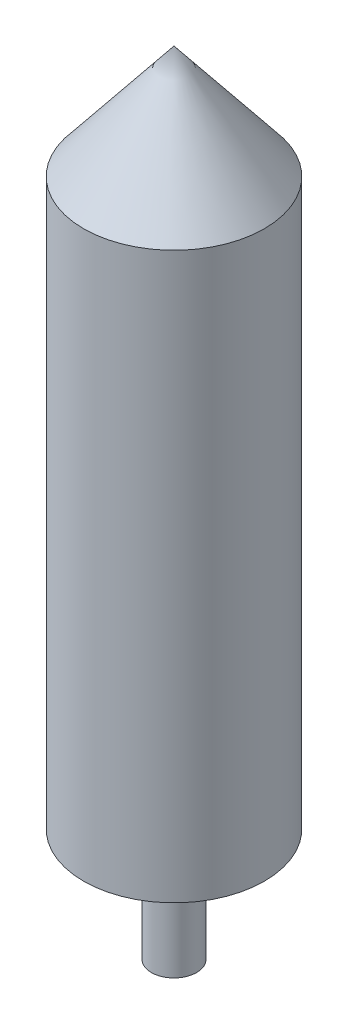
SolidWorks part; units mm, degrees
ref_plane "Front Plane" through (0, 0, 0) normal (0, 0, 1) x (1, 0, 0)
ref_plane "Top Plane" through (0, 0, 0) normal (0, 1, 0) x (1, 0, 0)
ref_plane "Right Plane" through (0, 0, 0) normal (1, 0, 0) x (0, 0, -1)
sketch "Sketch1" plane through (0, 0, 0) normal (0, 0, 1) x (1, 0, 0)
  line L14 (2, 10) -> (8, 10)
  line L17 (8, 10) -> (8, 60)
  line L18 (8, 60) -> (0, 70)
  line L19 (0, 70) -> (0, 0) construction
  line L20 (0, 70) -> (0, 0)
  line L21 (0, 0) -> (2, 0)
  line L22 (2, 0) -> (2, 10)
  dimension "D4" = 2
  dimension "D1" = 70
  dimension "D2" = 6
  dimension "D3" = 50
  dimension "D5" = 10
revolve "Revolve8" add sketch "Sketch1" angle 360 about L19
